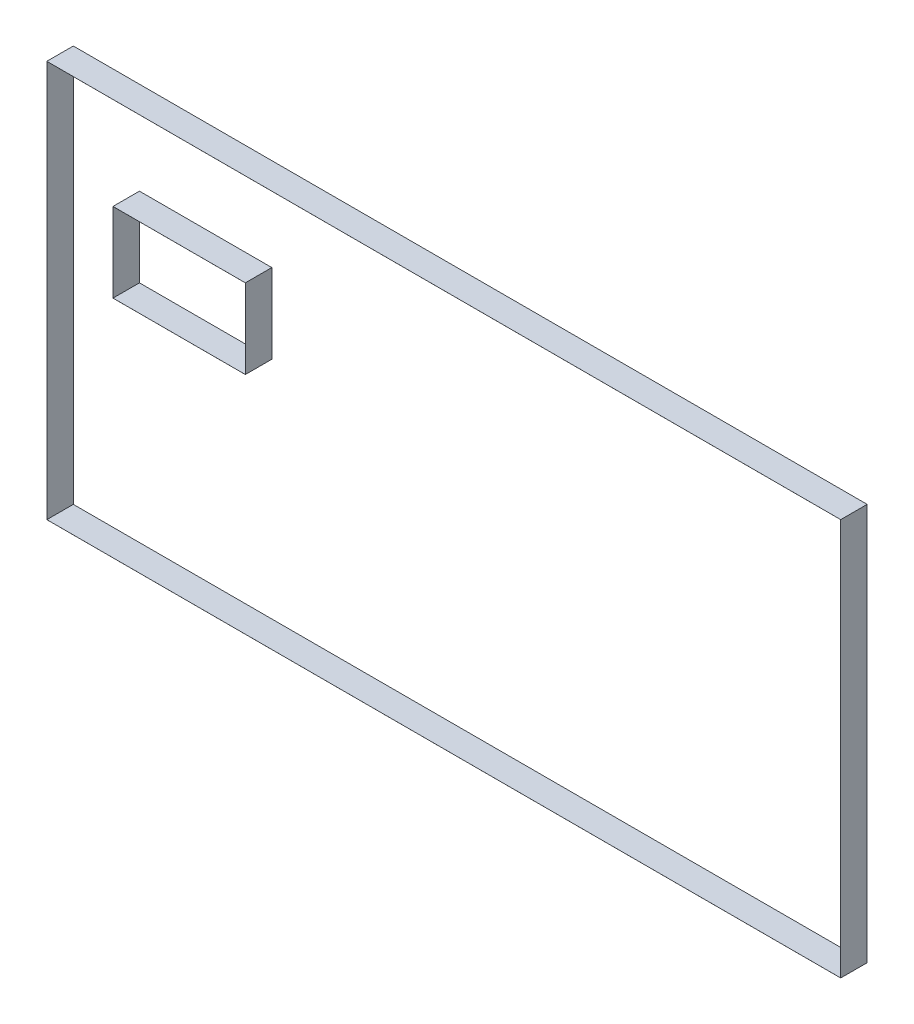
SolidWorks part; units mm, degrees
ref_plane "Plan XY" through (0, 0, 0) normal (0, 0, 1) x (1, 0, 0)
ref_plane "Plan XZ" through (0, 0, 0) normal (0, 1, 0) x (1, 0, 0)
ref_plane "Plan YZ" through (0, 0, 0) normal (1, 0, 0) x (0, 0, -1)
other "Centre de masse"
sketch "1 poste" plane through (0, 0, 0) normal (0, 0, 1) x (1, 0, 0)
  line L0 (2.5, 10) -> (7.5, 10) construction
  line L1 (0, 0) -> (30, 0)
  line L2 (0, 0) -> (0, 15)
  line L3 (0, 15) -> (30, 15)
  line L4 (30, 0) -> (30, 15)
  line L5 (2.5, 11.5) -> (7.5, 11.5)
  line L6 (2.5, 11.5) -> (2.5, 8.5)
  line L7 (2.5, 8.5) -> (7.5, 8.5)
  line L8 (7.5, 11.5) -> (7.5, 8.5)
  line L9 (5, 11.5) -> (5, 8.5) construction
  dimension "D1" = 30
  dimension "D2" = 15
  dimension "D3" = 5
  dimension "D4" = 3
  dimension "D5" = 10
  dimension "D6" = 5
extrude "Extru.-Mince1" add sketch "1 poste" along normal blind 1 thin
other "Point de référence du centre de masse1"
